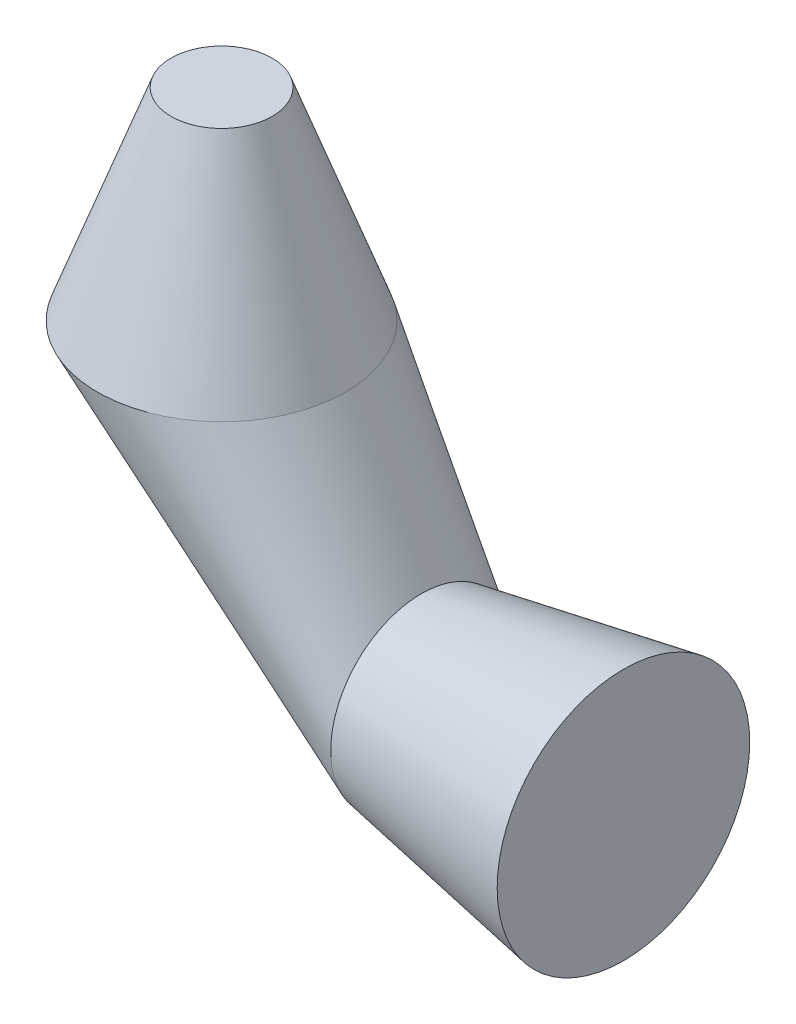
SolidWorks part; units mm, degrees
ref_plane "Front Plane" through (0, 0, 0) normal (0, 0, 1) x (1, 0, 0)
ref_plane "Top Plane" through (0, 0, 0) normal (0, 1, 0) x (1, 0, 0)
ref_plane "Right Plane" through (0, 0, 0) normal (1, 0, 0) x (0, 0, -1)
sketch "Sketch1" plane through (0, 0, 0) normal (0, 0, 1) x (1, 0, 0)
  line L0 (0, 0) -> (-40, -7.0531)
  line L1 (-40, -7.0531) -> (-40, -25)
  line L2 (-40, -25) -> (0, -25)
  line L3 (0, -25) -> (0, 0)
  line L4 (0, 0) -> (-29.6564, 0) construction
  dimension "D1" = 10
  dimension "D2" = 25
  dimension "D3" = 40
revolve "Revolve1" add sketch "Sketch1" angle 360 about L2
sketch "Sketch2" plane through (0, 0, 0) normal (0, 0, 1) x (1, 0, 0)
  line L0 (0, 0) -> (0, 88.9971) construction
  line L2 (-40, -7.0531) -> (-40, -42.9469) construction
  line L3 (-79.5588, 60) -> (-79.5588, 20)
  line L9 (-69.5588, 60) -> (-79.5588, 60)
  line L10 (-55, 20) -> (-69.5588, 60)
  line L11 (-79.5588, 20) -> (-55, 20)
  dimension "D1" = 20
  dimension "D2" = 10
  dimension "D3" = 15
  dimension "D4" = 70
  dimension "D5" = 40
revolve "Revolve2" add sketch "Sketch2" angle 360 about L3
loft "Loft1" add
